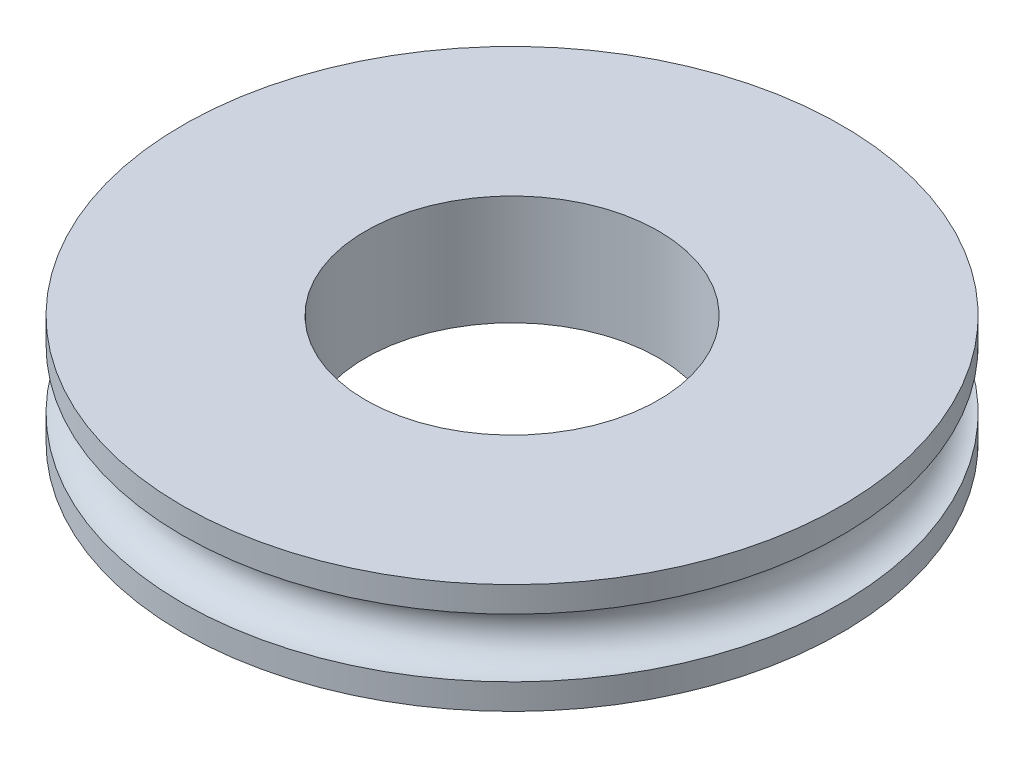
SolidWorks part; units mm, degrees
ref_plane "Front Plane" through (0, 0, 0) normal (0, 0, 1) x (1, 0, 0)
ref_plane "Top Plane" through (0, 0, 0) normal (0, 1, 0) x (1, 0, 0)
ref_plane "Right Plane" through (0, 0, 0) normal (1, 0, 0) x (0, 0, -1)
sketch "Sketch1" plane through (0, 0, 0) normal (0, 0, 1) x (1, 0, 0)
  line L0 (0, 27.4959) -> (0, -29.8824) construction
  line L1 (28.575, -2.54) -> (28.575, -4.7625)
  line L2 (12.7, 4.7625) -> (28.575, 4.7625)
  line L3 (12.7, 4.7625) -> (12.7, -4.7625)
  line L4 (12.7, -4.7625) -> (28.575, -4.7625)
  line L5 (28.575, 4.7625) -> (28.575, 2.54)
  arc A0 (28.575, 2.54) -> (28.575, -2.54) centre (28.575, 0) ccw
  point P7 (12.7, 0)
  dimension "D4" = 2.54
  dimension "D1" = 28.575
  dimension "D2" = 12.7
  dimension "D3" = 9.525
revolve "Revolve1" add sketch "Sketch1" angle 360 about L0
